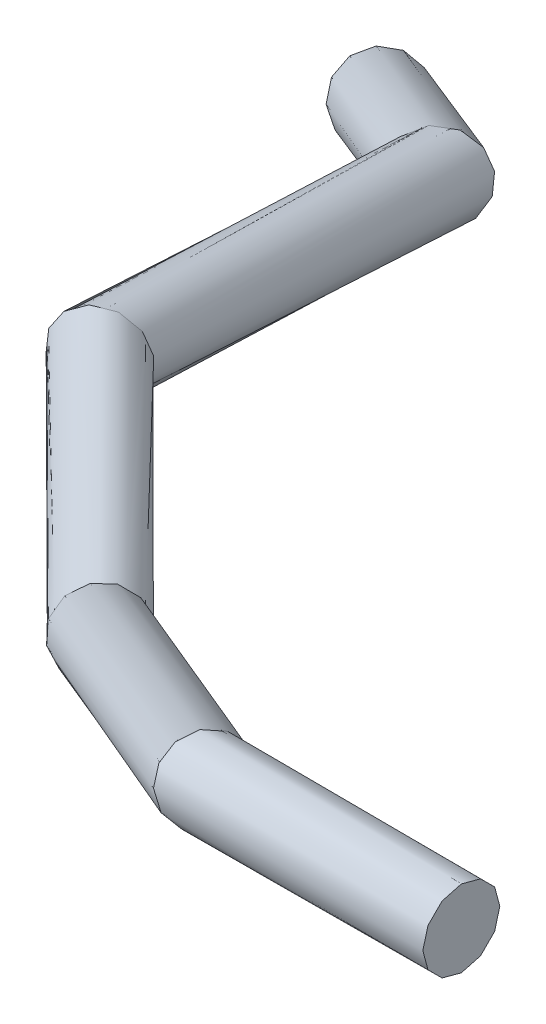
SolidWorks part; units mm, degrees
ref_plane "Ebene vorne" through (0, 0, 0) normal (0, 0, 1) x (1, 0, 0)
ref_plane "Ebene oben" through (0, 0, 0) normal (0, 1, 0) x (1, 0, 0)
ref_plane "Ebene rechts" through (0, 0, 0) normal (1, 0, 0) x (0, 0, -1)
mirrored part "test_04_Gespiegelt"
other "<test_04>-<Austragung1>"
equation "\"Breite\"=25"
equation "\"Wandstärke\"=2"
